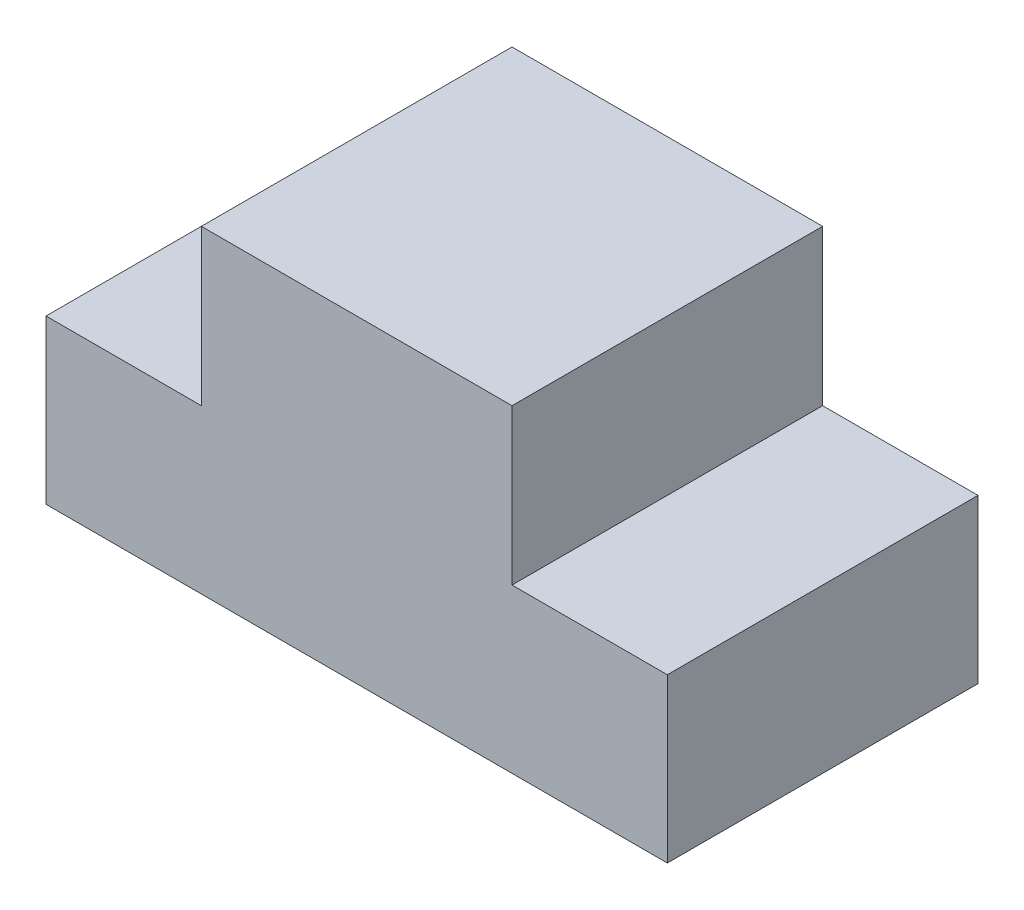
SolidWorks part; units mm, degrees
ref_plane "Front" through (0, 0, 0) normal (0, 0, 1) x (1, 0, 0)
ref_plane "Top" through (0, 0, 0) normal (0, 1, 0) x (1, 0, 0)
ref_plane "Right" through (0, 0, 0) normal (1, 0, 0) x (0, 0, -1)
sketch "Sketch1" plane through (0, 0, 0) normal (0, 0, 1) x (1, 0, 0)
  line L1 (-76.2, 0) -> (76.2, 0)
  line L2 (-76.2, 0) -> (-76.2, 40)
  line L3 (-76.2, 40) -> (76.2, 40)
  line L4 (76.2, 0) -> (76.2, 40)
  point P4 (0, 0)
  dimension "D1" = 152.4
  dimension "D2" = 40
extrude "Extrude1" add sketch "Sketch1" along normal mid plane 76.2
sketch "Sketch3" plane through (0, 40, 0) normal (0, 1, 0) x (-1, 0, 0)
  line L0 (-76.2, 38.1) -> (76.2, 38.1) construction
  line L1 (-38.1, 38.1) -> (38.1, 38.1)
  line L2 (-38.1, 38.1) -> (-38.1, -38.1)
  line L3 (-38.1, -38.1) -> (38.1, -38.1)
  line L4 (38.1, 38.1) -> (38.1, -38.1)
  line L5 (-76.2, -38.1) -> (76.2, -38.1) construction
  point P8 (0, 38.1)
  dimension "D1" = 76.2
extrude "Extrude2" add sketch "Sketch3" along normal blind 38.1
